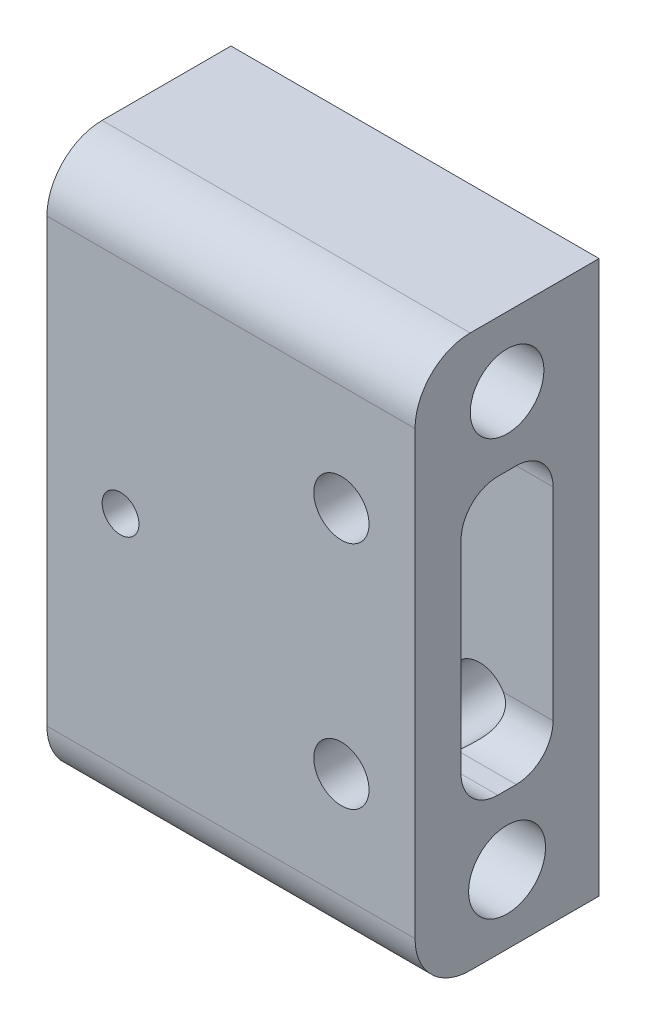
SolidWorks part; units mm, degrees
ref_plane "Alzado" through (0, 0, 0) normal (0, 0, 1) x (1, 0, 0)
ref_plane "Planta" through (0, 0, 0) normal (0, 1, 0) x (1, 0, 0)
ref_plane "Vista lateral" through (0, 0, 0) normal (1, 0, 0) x (0, 0, -1)
sketch "Croquis1" plane through (0, 0, 0) normal (0, 0, 1) x (1, 0, 0)
  line L1 (0, 0) -> (40, 0)
  line L2 (0, 0) -> (0, 60)
  line L3 (0, 60) -> (40, 60)
  line L4 (40, 0) -> (40, 60)
  dimension "D1" = 60
  dimension "D2" = 40
extrude "Saliente-Extruir1" add sketch "Croquis1" along normal blind 20
sketch "Croquis2" plane through (0, 0, 0) normal (-1, 0, 0) x (0, 0, 1)
  line L0 (5, 30) -> (0, 30) construction
  line L1 (5, 45) -> (15, 45)
  line L2 (5, 45) -> (5, 15)
  line L3 (5, 15) -> (15, 15)
  line L4 (15, 45) -> (15, 15)
  line L5 (0, 60) -> (0, 0) construction
  line L6 (10, 45) -> (10, 52.5) construction
  line L7 (10, 7.5) -> (10, 15) construction
  line L8 (15, 30) -> (20, 30) construction
  line L9 (20, 60) -> (20, 0) construction
  circle A0 centre (10, 52.5) radius 4
  circle A1 centre (10, 7.5) radius 4.1789
  dimension "D1" = 8
  dimension "D4" = 45
  dimension "D2" = 30
  dimension "D3" = 10
extrude "Cortar-Extruir1" cut sketch "Croquis2" against normal through all
fillet "Redondeo1" radius 4 4 edges at (20, 15, 5) (20, 15, 15) (20, 45, 15) (20, 45, 5)
sketch "Croquis3" plane through (0, 0, 20) normal (0, 0, 1) x (1, 0, 0)
  line L0 (8, 30) -> (8, 0) construction
  line L1 (8, 30) -> (0, 30) construction
  line L2 (0, 60) -> (0, 0) construction
  line L3 (8, 30) -> (8, 60) construction
  line L4 (40, 60) -> (0, 60) construction
  line L5 (0, 0) -> (40, 0) construction
  line L6 (32, 42.5) -> (32, 60) construction
  line L7 (32, 42.5) -> (32, 17.5) construction
  line L8 (32, 17.5) -> (32, 0) construction
  line L9 (32, 17.5) -> (40, 17.5) construction
  line L10 (40, 0) -> (40, 60) construction
  line L11 (32, 42.5) -> (40, 42.5) construction
  circle A0 centre (8, 30) radius 2
  circle A1 centre (32, 42.5) radius 3
  circle A2 centre (32, 17.5) radius 3
  dimension "D1" = 4
  dimension "D3" = 6
  dimension "D4" = 25
  dimension "D2" = 8
  dimension "D5" = 8
extrude "Cortar-Extruir2" cut sketch "Croquis3" against normal through all
fillet "Redondeo2" radius 6 2 edges at (20, 0, 20) (20, 60, 20)
